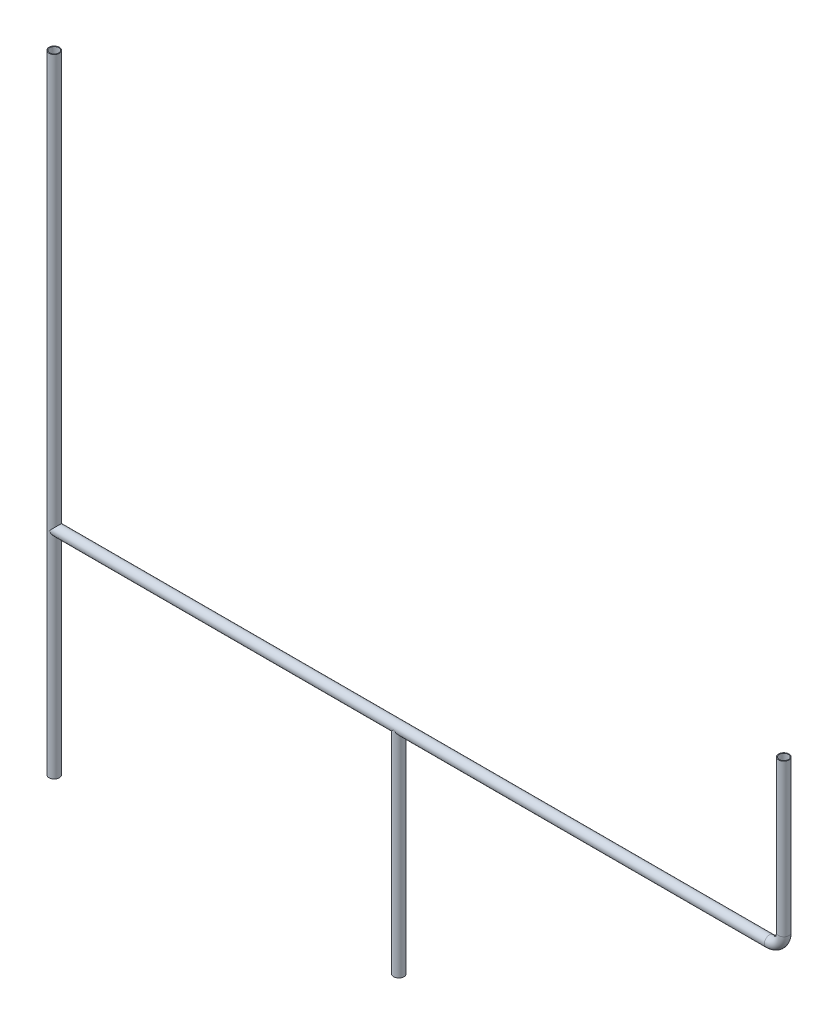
SolidWorks part; units mm, degrees
ref_plane "Alzado" through (0, 0, 0) normal (0, 0, 1) x (1, 0, 0)
ref_plane "Planta" through (0, 0, 0) normal (0, 1, 0) x (1, 0, 0)
ref_plane "Vista lateral" through (0, 0, 0) normal (1, 0, 0) x (0, 0, -1)
sketch "Croquis1" plane through (0, 0, 0) normal (0, 0, 1) x (1, 0, 0)
  line L0 (1429.1421, 0) -> (649.1421, 0)
  line L1 (649.1421, 0) -> (649.1421, -450)
  line L2 (649.1421, 0) -> (-75.8579, 0)
  line L3 (-75.8579, 0) -> (-75.8579, -450)
  line L4 (-75.8579, 0) -> (-75.8579, 870)
  line L5 (1459.1421, 30) -> (1459.1421, 350)
  arc A0 (1429.1421, 0) -> (1459.1421, 30) centre (1429.1421, 30) ccw
  point P10 (1459.1421, 0)
  dimension "D7" = 30
  dimension "D1" = 350
  dimension "D2" = 810
  dimension "D3" = 450
  dimension "D4" = 450
  dimension "D5" = 725
  dimension "D6" = 870
ref_plane "Plano1" through (1459.1421, 350, 0) normal (0, -1, 0) x (1, 0, 0)
sketch "Croquis2" plane through (1459.1421, 350, 0) normal (0, -1, 0) x (1, 0, 0)
  circle A0 centre (0, 0) radius 11
  circle A1 centre (0, 0) radius 9.5
  dimension "D1" = 22
  dimension "D2" = 19
sweep "Barrer1" add profiles "Croquis2" path "Croquis1"
ref_plane "Plano2" through (649.1421, -450, 0) normal (0, -1, 0) x (1, 0, 0)
ref_plane "Plano3" through (-75.8579, -450, 0) normal (0, -1, 0) x (1, 0, 0)
sketch "Croquis3" plane through (-75.8579, -450, 0) normal (0, -1, 0) x (1, 0, 0)
  circle A0 centre (0, 0) radius 11
  circle A1 centre (0, 0) radius 9.5
  circle A2 centre (725, 0) radius 11
  circle A3 centre (725, 0) radius 9.5
  dimension "D1" = 22
  dimension "D2" = 19
  dimension "D3" = 22
  dimension "D4" = 19
extrude "Saliente-Extruir1" add sketch "Croquis3" against normal up to vertex
ref_plane "Plano4" through (0, 0, 0) normal (1, 0, 0) x (0, 0, -1)
